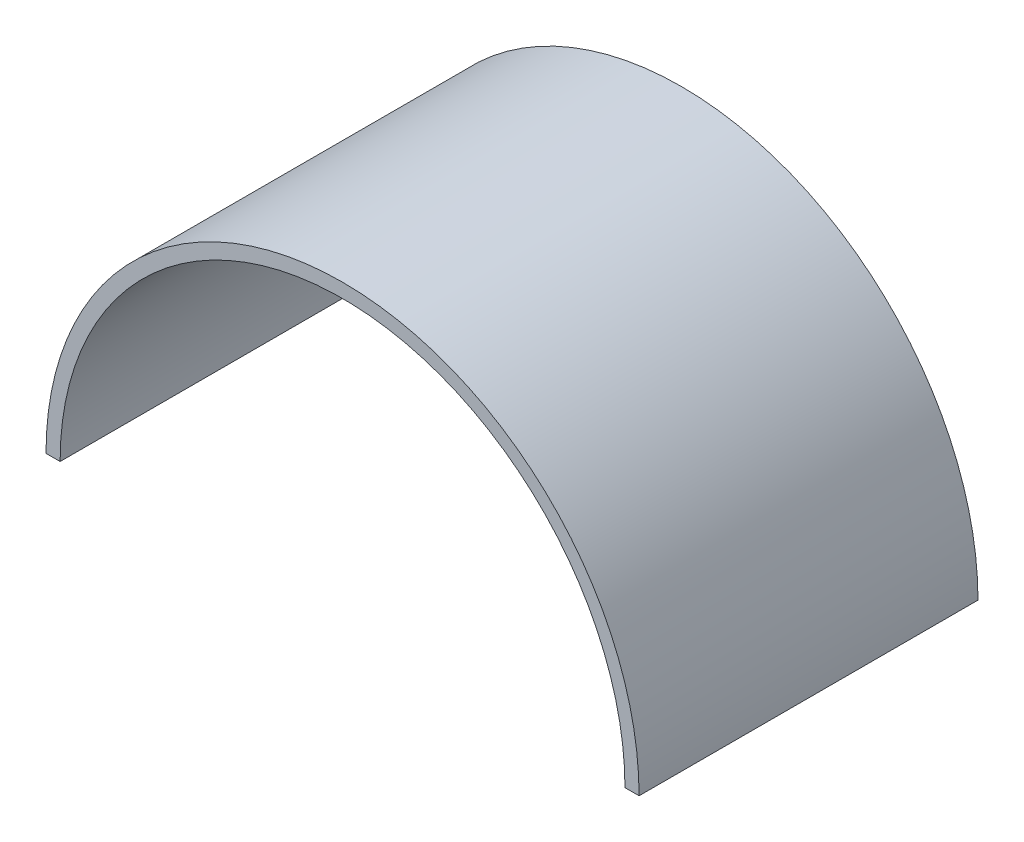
SolidWorks part; units mm, degrees
ref_plane "Front Plane" through (0, 0, 0) normal (0, 0, 1) x (1, 0, 0)
ref_plane "Top Plane" through (0, 0, 0) normal (0, 1, 0) x (1, 0, 0)
ref_plane "Right Plane" through (0, 0, 0) normal (1, 0, 0) x (0, 0, -1)
sketch "Sketch1" plane through (0, 0, 0) normal (0, 0, 1) x (1, 0, 0)
  line L0 (-55.372, 109.22) -> (-52.197, 109.22)
  line L1 (-182.372, 109.22) -> (-185.547, 109.22)
  line L2 (-55.372, 109.22) -> (-182.372, 109.22) construction
  arc A0 (-55.372, 109.22) -> (-182.372, 109.22) centre (-118.872, 109.22) ccw
  arc A1 (-55.372, 109.22) -> (-182.372, 109.22) centre (-118.872, 109.22) ccw construction
  arc A2 (-52.197, 109.22) -> (-185.547, 109.22) centre (-118.872, 109.22) ccw
  dimension "D1" = 63.5
  dimension "D2" = 3.175
extrude "Boss-Extrude1" add sketch "Sketch1" along normal blind 76.2
